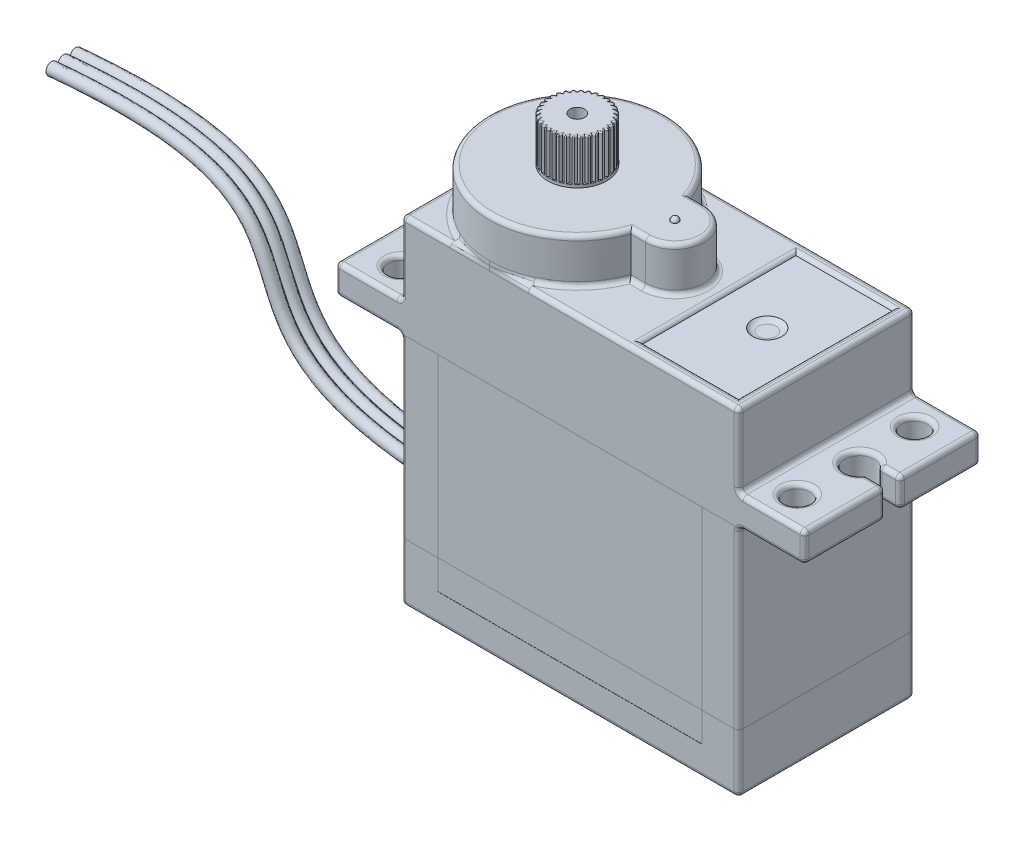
SolidWorks part; units mm, degrees
ref_plane "Plano frontal" through (0, 0, 0) normal (0, 0, 1) x (1, 0, 0)
ref_plane "Plano superior" through (0, 0, 0) normal (0, 1, 0) x (1, 0, 0)
ref_plane "Plano direito" through (0, 0, 0) normal (1, 0, 0) x (0, 0, -1)
sketch "Esboço1" plane through (0, 0, 0) normal (0, 1, 0) x (1, 0, 0)
  line L1 (11.5, -6) -> (-11.5, -6)
  line L2 (11.5, -6) -> (11.5, 6)
  line L3 (11.5, 6) -> (-11.5, 6)
  line L4 (-11.5, -6) -> (-11.5, 6)
  line L5 (11.5, -6) -> (-11.5, 6) construction
  line L6 (11.5, 6) -> (-11.5, -6) construction
  point P0 (0, 0)
  dimension "D1" = 12
  dimension "D2" = 23
extrude "Ressalto-extrusão1" add sketch "Esboço1" along normal blind 23
sketch "Esboço2" plane through (11.5, 0, 0) normal (1, 0, 0) x (0, 0, -1)
  line L0 (-6, 23) -> (-6, 0) construction
  line L1 (-6, 18) -> (6, 18)
  line L2 (-6, 18) -> (-6, 16)
  line L3 (-6, 16) -> (6, 16)
  line L4 (6, 18) -> (6, 16)
  line L5 (6, 23) -> (6, 0) construction
  line L6 (-6, 0) -> (6, 0) construction
  dimension "D1" = 16
  dimension "D2" = 2
extrude "Ressalto-extrusão2" add sketch "Esboço2" along normal blind 4.5
sketch "Esboço3" plane through (0, 18, 0) normal (0, 1, 0) x (1, 0, 0)
  line L0 (16, 6) -> (16, -6) construction
  line L1 (16, -6) -> (11.5, -6) construction
  line L2 (14.616, -0.5) -> (16, -0.5)
  line L3 (16, -0.5) -> (16, 0.5) construction
  line L4 (16, 0.5) -> (14.616, 0.5)
  arc A0 (14.616, 0.5) -> (14.616, -0.5) centre (13.75, 0) ccw
  point P1 (16, 0)
  point P10 (13.75, -6)
  dimension "D2" = 1
  dimension "D1" = 1
extrude "Corte-extrusão1" cut sketch "Esboço3" against normal through all
mirror "Espelhar1" about plane through (0, 0, 0) normal (1, 0, 0) of "Corte-extrusão1", "Ressalto-extrusão2"
sketch "Esboço4" plane through (0, 23, 0) normal (0, 1, 0) x (1, 0, 0)
  line L1 (-11.5, 6) -> (-11.5, -6) construction
  line L2 (11.5, 6) -> (-11.5, 6) construction
  line L3 (0.1569, 2) -> (1.1569, 2)
  line L4 (1.1569, -2) -> (0.1569, -2)
  line L5 (-11.5, -6) -> (11.5, -6) construction
  arc A0 (0.1569, 2) -> (0.1569, -2) centre (-5.5, 0) ccw
  arc A1 (1.1569, 2) -> (1.1569, -2) centre (1.1569, 0) cw
  dimension "D1" = 2
  dimension "D2" = 1
extrude "Ressalto-extrusão3" add sketch "Esboço4" along normal blind 3
sketch "Esboço5" plane through (0, 26, 0) normal (0, 1, 0) x (1, 0, 0)
  circle A0 centre (-5.5, 0) radius 2
  dimension "D1" = 4
extrude "Corte-extrusão2" cut sketch "Esboço5" against normal blind 1
sketch "Esboço6" plane through (0, 25, 0) normal (0, 1, 0) x (1, 0, 0)
  circle A0 centre (-5.5, 0) radius 2
  circle A1 centre (-5.5, 0) radius 2 construction
extrude "Ressalto-extrusão4" add sketch "Esboço6" along normal blind 4 separate body
sketch "Esboço7" plane through (0, 29, 0) normal (0, 1, 0) x (1, 0, 0)
  line L0 (-5.5, -2.1414) -> (-5.6414, -2)
  line L1 (-5.5, -2.1414) -> (-5.3586, -2)
  line L2 (-5.6414, -2) -> (-5.5, -1.8586)
  line L3 (-5.3586, -2) -> (-5.5, -1.8586)
  line L4 (-5.5, -2.1414) -> (-5.5, -1.8586) construction
  line L5 (-5.6414, -2) -> (-5.3586, -2) construction
  line L6 (-5.5, 0) -> (-5.5, -2) construction
  circle A1 centre (-5.5, 0) radius 2 construction
  point P1 (-5.5, -2)
  dimension "D1" = 0.2
extrude "Corte-extrusão3" cut sketch "Esboço7" against normal blind 2.8
pattern_circular "PadrãoCircular1" count 32 over 360 about axis through (-5.5, 0, 0) along (0, 1, 0) of "Corte-extrusão3"
sketch "Esboço9" plane through (0, 26, 0) normal (0, 1, 0) x (1, 0, 0)
  circle A0 centre (1.1569, 0) radius 0.25
  dimension "D1" = 0.5
extrude "Ressalto-extrusão5" add sketch "Esboço9" along normal blind 0.25
fillet "Filete1" radius 0.1 96 edges at (-6.0806, 29, 1.9139) (-6.1742, 29, 1.8064) (-6.3006, 29, 1.7541) (-6.4428, 29, 1.7638) (-6.5137, 29, 1.6402) (-6.6274, 29, 1.5642) (-6.7688, 29, 1.546) (-6.8142, 29, 1.4109) (-6.9109, 29, 1.3142) (-7.046, 29, 1.2688) (-7.0642, 29, 1.1274) (-7.1402, 29, 1.0137) (-7.2638, 29, 0.9428) (-7.2541, 29, 0.8006) (-7.3064, 29, 0.6742) (-7.4139, 29, 0.5806) (-7.3766, 29, 0.443) (-7.4033, 29, 0.3089) (-7.4904, 29, 0.196) (-7.4269, 29, 0.0684) (-7.4269, 29, -0.0684) (-7.4904, 29, -0.196) (-7.4033, 29, -0.3089) (-7.3766, 29, -0.443) (-7.4139, 29, -0.5806) (-7.3064, 29, -0.6742) (-7.2541, 29, -0.8006) (-7.2638, 29, -0.9428) (-7.1402, 29, -1.0137) (-7.0642, 29, -1.1274) (-7.046, 29, -1.2688) (-6.9109, 29, -1.3142) (-6.8142, 29, -1.4109) (-6.7688, 29, -1.546) (-6.6274, 29, -1.5642) (-6.5137, 29, -1.6402) (-6.4428, 29, -1.7638) (-6.3006, 29, -1.7541) (-6.1742, 29, -1.8064) (-6.0806, 29, -1.9139) (-5.943, 29, -1.8766) (-5.8089, 29, -1.9033) (-5.696, 29, -1.9904) (-5.5684, 29, -1.9269) (-5.4316, 29, -1.9269) (-5.304, 29, -1.9904) (-5.1911, 29, -1.9033) (-5.057, 29, -1.8766) (-4.9194, 29, -1.9139) (-4.8258, 29, -1.8064) (-4.6994, 29, -1.7541) (-4.5572, 29, -1.7638) (-4.4863, 29, -1.6402) (-4.3726, 29, -1.5642) (-4.2312, 29, -1.546) (-4.1858, 29, -1.4109) (-4.0891, 29, -1.3142) (-3.954, 29, -1.2688) (-3.9358, 29, -1.1274) (-3.8598, 29, -1.0137) (-3.7362, 29, -0.9428) (-3.7459, 29, -0.8006) (-3.6936, 29, -0.6742) (-3.5861, 29, -0.5806) (-3.6234, 29, -0.443) (-3.5967, 29, -0.3089) (-3.5096, 29, -0.196) (-3.5731, 29, -0.0684) (-3.5731, 29, 0.0684) (-3.5096, 29, 0.196) (-3.5967, 29, 0.3089) (-3.6234, 29, 0.443) (-3.5861, 29, 0.5806) (-3.6936, 29, 0.6742) (-3.7459, 29, 0.8006) (-3.7362, 29, 0.9428) (-3.8598, 29, 1.0137) (-3.9358, 29, 1.1274) (-3.954, 29, 1.2688) (-4.0891, 29, 1.3142) (-4.1858, 29, 1.4109) (-4.2312, 29, 1.546) (-4.3726, 29, 1.5642) (-4.4863, 29, 1.6402) (-4.5572, 29, 1.7638) (-4.6994, 29, 1.7541) (-4.8258, 29, 1.8064) (-4.9194, 29, 1.9139) (-5.057, 29, 1.8766) (-5.1911, 29, 1.9033) (-5.304, 29, 1.9904) (-5.4316, 29, 1.9269) (-5.5684, 29, 1.9269) (-5.696, 29, 1.9904) (-5.8089, 29, 1.9033) (-5.943, 29, 1.8766)
sketch "Esboço10" plane through (0, 18, 0) normal (0, 1, 0) x (1, 0, 0)
  line L0 (-11.5, 0) -> (-13.75, 0) construction
  line L1 (-11.5, 6) -> (-11.5, -6) construction
  line L2 (0, 6) -> (0, 0) construction
  line L3 (11.5, 6) -> (-5.5, 6) construction
  line L4 (-16, 6) -> (-11.5, 6) construction
  circle A0 centre (-13.5, 4) radius 0.875
  circle A1 centre (-13.5, -4) radius 0.875
  circle A2 centre (13.5, -4) radius 0.875
  circle A3 centre (13.5, 4) radius 0.875
  dimension "D3" = 1.75
  dimension "D1" = 2
  dimension "D2" = 2
extrude "Corte-extrusão4" cut sketch "Esboço10" against normal up to surface (2 mm away)
sketch "Esboço11" plane through (0, 0, 0) normal (0, -1, 0) x (1, 0, 0)
  line L0 (0, 0) -> (0, 6) construction
  line L1 (-11.5, 6) -> (11.5, 6) construction
  line L2 (-11.5, 0) -> (0, 0) construction
  line L3 (-11.5, -6) -> (-11.5, 6) construction
  circle A0 centre (-10.5, 5) radius 0.5
  circle A1 centre (-10.5, -5) radius 0.5
  circle A2 centre (10.5, -5) radius 0.5
  circle A3 centre (10.5, 5) radius 0.5
  dimension "D3" = 1
  dimension "D1" = 1
  dimension "D2" = 1
extrude "Corte-extrusão5" cut sketch "Esboço11" against normal blind 21
sketch "Esboço12" plane through (0, 23, 0) normal (0, 1, 0) x (1, 0, 0)
  line L0 (11.5, -6) -> (11.5, 6) construction
  line L1 (4.1569, 5.25) -> (10.75, 5.25)
  line L2 (4.1569, 5.25) -> (4.1569, -5.25)
  line L3 (4.1569, -5.25) -> (10.75, -5.25)
  line L4 (10.75, 5.25) -> (10.75, -5.25)
  line L5 (11.5, 6) -> (-5.5, 6) construction
  line L6 (-5.5, -6) -> (11.5, -6) construction
  arc A0 (1.1569, -2) -> (1.1569, 2) centre (1.1569, 0) ccw construction
  point P10 (3.1569, 0)
  dimension "D1" = 0.75
  dimension "D2" = 0.75
  dimension "D3" = 0.75
  dimension "D4" = 1
extrude "Corte-extrusão6" cut sketch "Esboço12" against normal blind 0.2
sketch "Esboço13" plane through (0, 22.8, 0) normal (0, 1, 0) x (1, 0, 0)
  line L0 (4.1569, -5.25) -> (10.75, -5.25) construction
  line L3 (4.1569, 5.25) -> (4.1569, -5.25) construction
  circle A0 centre (7.4534, 0) radius 1
  point P4 (7.4534, -5.25)
  point P7 (4.1569, 0)
  dimension "D1" = 2
extrude "Corte-extrusão7" cut sketch "Esboço13" against normal blind 0.2
sketch "Esboço14" plane through (0, 0, 0) normal (0, -1, 0) x (1, 0, 0)
  line L0 (0, 6) -> (0, 0) construction
  line L1 (-11.5, 6) -> (11.5, 6) construction
  line L2 (0, 0) -> (-11.5, 0) construction
  line L3 (-11.5, -6) -> (-11.5, 6) construction
  circle A0 centre (-10.5, 5) radius 0.7
  circle A1 centre (-10.5, 5) radius 0.5 construction
  circle A2 centre (-10.5, -5) radius 0.7
  circle A3 centre (10.5, -5) radius 0.7
  circle A4 centre (10.5, 5) radius 0.7
  dimension "D1" = 0.2
extrude "Corte-extrusão8" cut sketch "Esboço14" against normal blind 0.4
fillet "Filete2" radius 0.3 94 edges at (11.5, 23, 0) (-13.5, 18, 3.125) (-13.5, 16, 3.125) (13.5, 18, 4.875) (13.5, 16, 3.125) (13.5, 18, -4.875) (13.5, 16, -4.875) (3, 23, -6) (4.1569, 22.9, 5.25) (4.1569, 22.9, -5.25) (10.75, 22.9, -5.25) (10.75, 22.9, 5.25) (4.1569, 23, 0) (7.4534, 23, 5.25) (10.75, 23, 0) (7.4534, 23, -5.25) (-10.5, 0, 4.3) (-10.5, 0, -4.3) (10.5, 0, -5.7) (10.5, 0, 5.7) (16, 17, 6) (16, 16, 3.25) (16, 17, -6) (16, 18, -3.25) (16, 16, -3.25) (16, 18, 3.25) (14.616, 17, 0.5) (12.75, 16, 0) (12.75, 18, 0) (16, 17, 0.5) (15.308, 16, 0.5) (15.308, 18, 0.5) (14.616, 17, -0.5) (15.308, 16, -0.5) (15.308, 18, -0.5) (16, 17, -0.5) (-11.5, 23, -3) (0, 0, -6) (-16, 17, 6) (-16, 18, -3.25) (-16, 17, -6) (-16, 16, 3.25) (11.5, 0, 0) (0, 0, 6) (-11.5, 0, 0) (-16, 18, 3.25) (-16, 16, -3.25) (-12.75, 16, 0) (-16, 17, 0.5) (-15.308, 18, -0.5) (-12.75, 18, 0) (-15.308, 18, 0.5) (-14.616, 17, 0.5) (-15.308, 16, 0.5) (-14.616, 17, -0.5) (-16, 17, -0.5) (-15.308, 16, -0.5) (-8.5, 23, 6) (-11.5, 23, 3) (3, 23, 6) (-8.5, 23, -6) (-2.0359, 23, 4.899) (-9.7426, 23, 4.2426) (-9.7426, 23, -4.2426) (-2.0359, 23, -4.899) (0.6569, 23, 2) (3.1569, 23, 0) (0.6569, 23, -2) (-11.5, 26, 0) (0.6569, 26, 2) (3.1569, 26, 0) (0.6569, 26, -2) (-13.5, 18, -3.125) (-13.5, 16, -4.875)
fillet "Filete3" radius 0.25 1 edges at (1.1569, 26.25, 0.25)
fillet "Filete4" radius 0.5 1 edges at (7.4534, 22.6, 1)
sketch "Esboço15" plane through (-11.5, 0, 0) normal (-1, 0, 0) x (0, 0, 1)
  line L1 (-1.25, 3.1) -> (1.25, 3.1)
  line L2 (-1.25, 3.1) -> (-1.25, 4)
  line L3 (-1.25, 4) -> (1.25, 4)
  line L4 (1.25, 3.1) -> (1.25, 4)
  line L5 (4.2859, 0) -> (-4.2859, 0) construction
  point P4 (0, 4)
  dimension "D1" = 0.9
  dimension "D2" = 2.5
  dimension "D3" = 4
extrude "Corte-extrusão9" cut sketch "Esboço15" against normal blind 1
sketch "Esboço16" plane through (-10.5, 0, 0) normal (-1, 0, 0) x (0, 0, 1)
  line L0 (-1.25, 3.55) -> (1.25, 3.55) construction
  line L1 (-1.25, 4) -> (-1.25, 3.1) construction
  line L2 (1.25, 3.1) -> (1.25, 4) construction
  line L3 (-0.4352, 3.675) -> (-0.3852, 3.675)
  line L4 (0.3852, 3.675) -> (0.4352, 3.675)
  line L5 (0.4352, 3.425) -> (0.3852, 3.425)
  line L6 (-0.3852, 3.425) -> (-0.4352, 3.425)
  arc A0 (-0.4352, 3.675) -> (-0.4352, 3.425) centre (-0.8205, 3.55) ccw
  arc A1 (-0.3852, 3.675) -> (0.3852, 3.675) centre (0, 3.55) cw
  arc A2 (-0.3852, 3.425) -> (0.3852, 3.425) centre (0, 3.55) ccw
  arc A3 (0.4352, 3.675) -> (0.4352, 3.425) centre (0.8205, 3.55) cw
  dimension "D1" = 0.405
  dimension "D2" = 0.25
  dimension "D3" = 0.05
sketch "Esboço17" plane through (0, 0, 0) normal (0, 0, 1) x (1, 0, 0)
  line L0 (-10.5, 3.955) -> (-10.5, 3.145) construction
  spline S0 degree 3 poles (-10.5, 3.55) (-35.3164, 3.0153) (-15.9205, 16.8081) (-40.5, 14.55) knots 0 0 0 0 1 1 1 1
  dimension "D1" = 16
  dimension "D2" = 14
  dimension "D3" = 8
  dimension "D4" = 3
ref_plane "Plano1" through (0, 16, 0) normal (0, -1, 0) x (-1, 0, 0)
ref_plane "Plano2" through (0, 4, 0) normal (0, -1, 0) x (-1, 0, 0)
split "Dividir1" trim tools "Plano1" bodies to split 118 resulting bodies 120 121
split "Dividir2" trim tools "Plano2" bodies to split 120 resulting bodies 125 126
sweep "Varredura1" add profiles "Esboço16" path "Esboço17"
hole_wizard "Furo roscado para conduíte de M2.2x0.451" positions "Esboço20" profile "Esboço18" tap size "M2.2x0.45" standard "Helicoil® Metric"
sketch "Esboço20" plane through (0, 29, 0) normal (0, 1, 0) x (1, 0, 0)
  point P5 (-5.5, 0)
sketch "Esboço18" plane through (-5.5, 29, 0) normal (1, 0, 0) x (0, 0, 1)
  line L0 (0, 0) -> (0, 3.3004)
  line L1 (0, 3.3004) -> (0.5, 3)
  line L2 (0.5, 3) -> (0.5, 0)
  line L5 (0.5, 0) -> (0, 0)
  line L10 (0, 3.3004) -> (-0.5, 3) construction
  line L11 (0, -6.35) -> (0, 107.95) construction
  dimension "Tap Drill Dia." = 1
  dimension "Tap Drill Depth" = 3
  dimension "Drill Angle" = 118
sketch "Esboço21" plane through (0, 0, 6) normal (0, 0, 1) x (1, 0, 0)
  line L0 (-6.27, 16) -> (6.27, 16) construction
  line L1 (-9, 16) -> (9, 16)
  line L2 (-9, 16) -> (-9, 2)
  line L3 (-9, 2) -> (9, 2)
  line L4 (9, 16) -> (9, 2)
  line L5 (11.2804, 16) -> (-11.2804, 16) construction
  point P6 (0, 16)
  dimension "D1" = 14
  dimension "D2" = 18
extrude "Corte-extrusão10" cut sketch "Esboço21" against normal blind 0.01
